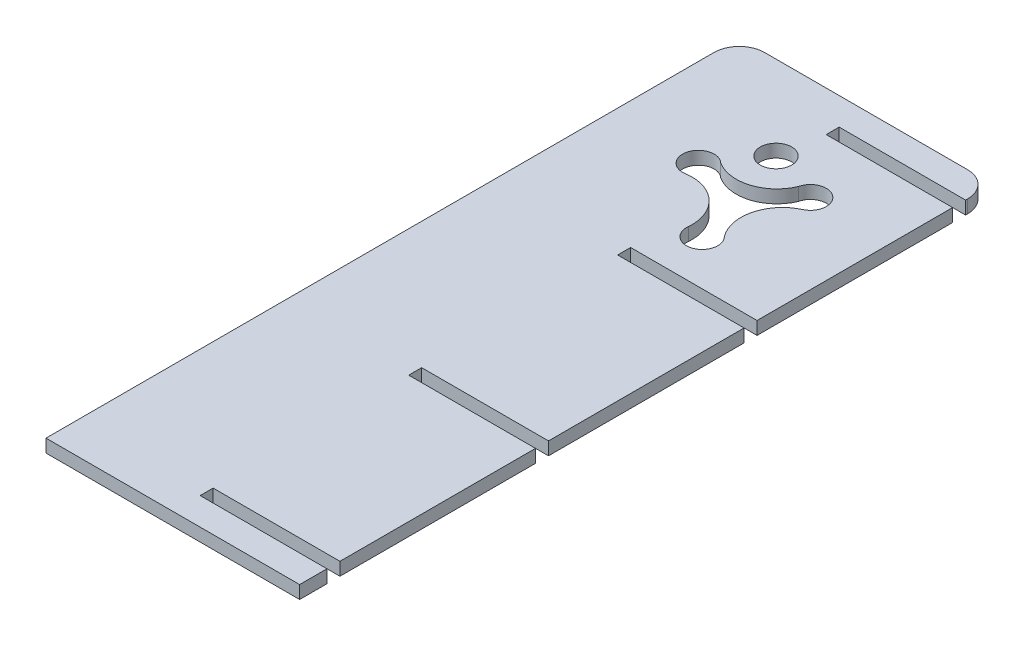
SolidWorks part; units mm, degrees
ref_plane "Alzado" through (0, 0, 0) normal (0, 0, 1) x (1, 0, 0)
ref_plane "Planta" through (0, 0, 0) normal (0, 1, 0) x (1, 0, 0)
ref_plane "Vista lateral" through (0, 0, 0) normal (1, 0, 0) x (0, 0, -1)
sketch "Croquis1" plane through (0, 0, 0) normal (0, 1, 0) x (1, 0, 0)
  line L0 (-56.986, -430.7706) -> (393.014, -430.7706)
  line L1 (393.014, 750.7294) -> (393.014, 754.2294)
  line L2 (348.014, 799.2294) -> (-11.986, 799.2294)
  line L3 (-56.986, 754.2294) -> (-56.986, -430.7706)
  line L4 (393.014, -430.7706) -> (393.014, -382.2706)
  line L6 (168.014, -382.2706) -> (168.014, -359.2706)
  line L8 (393.014, -359.2706) -> (393.014, -12.2706)
  line L10 (168.014, -12.2706) -> (168.014, 10.7294)
  line L12 (393.014, 10.7294) -> (393.014, 357.7294)
  line L14 (168.7164, 357.7294) -> (168.7164, 380.7294)
  line L16 (393.014, 380.7294) -> (393.014, 727.7294)
  line L18 (168.7164, 727.7294) -> (168.7164, 750.7294)
  line L20 (138.2417, 586.6549) -> (260.9084, 586.6549) construction
  line L29 (168.7164, 750.7294) -> (393.014, 750.7294)
  line L30 (393.014, 727.7294) -> (168.7164, 727.7294)
  line L31 (168.7164, 380.7294) -> (393.014, 380.7294)
  line L32 (393.014, 357.7294) -> (168.7164, 357.7294)
  line L33 (168.014, 10.7294) -> (393.014, 10.7294)
  line L34 (393.014, -12.2706) -> (168.014, -12.2706)
  line L35 (168.014, -359.2706) -> (393.014, -359.2706)
  line L36 (393.014, -382.2706) -> (168.014, -382.2706)
  arc A0 (393.014, 754.2294) -> (348.014, 799.2294) centre (348.014, 754.2294) ccw
  arc A1 (-11.986, 799.2294) -> (-56.986, 754.2294) centre (-11.986, 754.2294) ccw
  circle A2 centre (157.0938, 650.2779) radius 27.8616
  arc A3 (118.7567, 590.6006) -> (104.2681, 542.8263) centre (99.3313, 570.4076) ccw
  arc A4 (262.9876, 591.6496) -> (223.843, 623.2341) centre (251.2785, 617.1872) ccw
  arc A5 (187.8708, 464.0631) -> (234.9645, 480.7662) centre (215.5336, 460.8099) ccw
  arc A6 (223.843, 623.2341) -> (118.7567, 590.6006) centre (157.5253, 651.274) cw
  arc A7 (234.9645, 480.7662) -> (263.1417, 591.7208) centre (293.9583, 524.8397) cw
  arc A8 (187.747, 462.7389) -> (102.9297, 542.6199) centre (114.7743, 470.2266) ccw
  point P22 (393.014, 799.2294)
  dimension "D15" = 45
  dimension "D1" = 450
extrude "Saliente-Extruir1" add sketch "Croquis1" along normal blind 23
